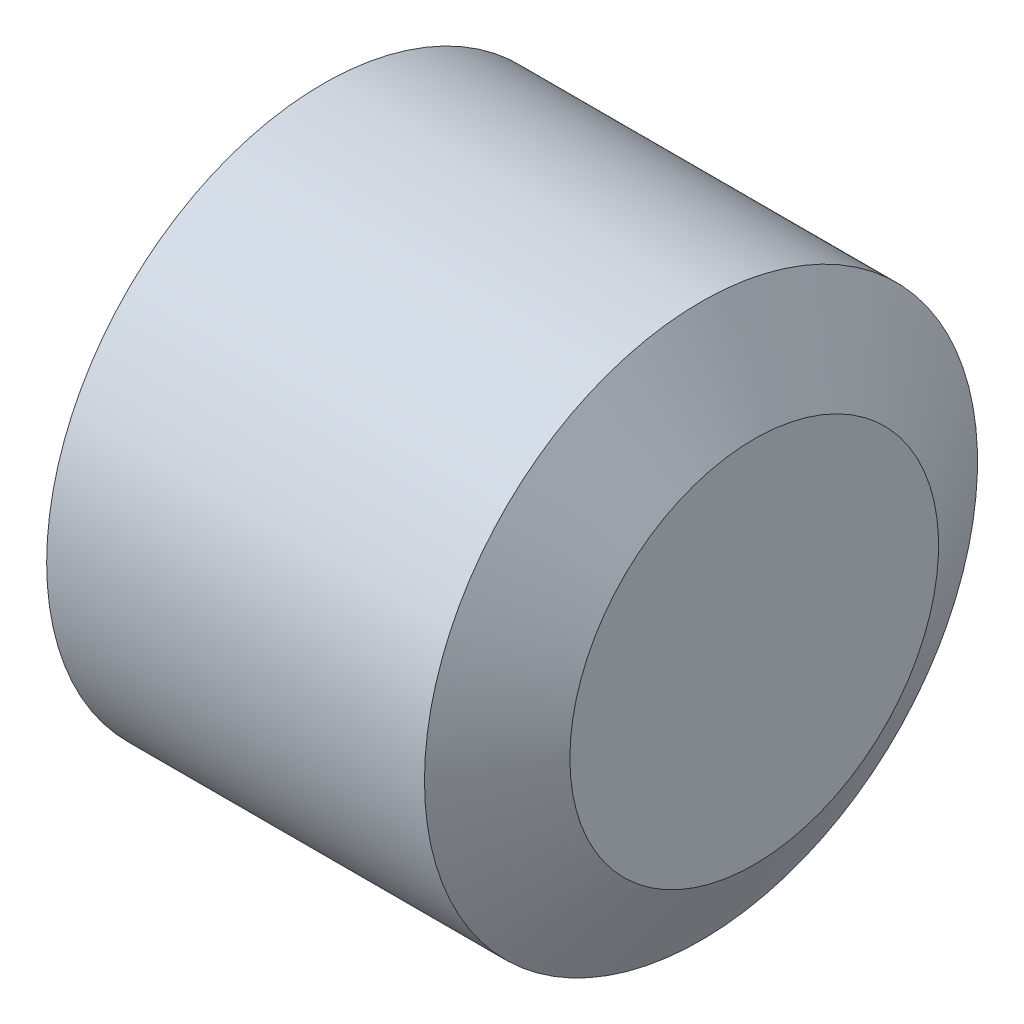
SolidWorks part; units mm, degrees
ref_plane "Plane1" through (0, 0, 0) normal (0, 0, 1) x (1, 0, 0)
ref_plane "Plane2" through (0, 0, 0) normal (0, 1, 0) x (1, 0, 0)
ref_plane "Plane3" through (0, 0, 0) normal (1, 0, 0) x (0, 0, -1)
sketch "BodySke" plane through (0, 0, 0) normal (0, 0, 1) x (1, 0, 0)
  line L0 (0, 0) -> (0, 1.2195)
  line L1 (0, 1.2195) -> (0.1619, 1.5)
  line L2 (0.1619, 1.5) -> (2.2113, 1.5)
  line L3 (2.2113, 1.5) -> (2.5, 1)
  line L4 (2.5, 0) -> (0, 0)
  line L5 (-12.7, 0) -> (88.9, 0) construction
  line L6 (2.5, 1) -> (2.5, 0)
  line L7 (2.5, 1) -> (2.5, 10.525) construction
  line L8 (0, -1.2195) -> (0.1619, -1.5) construction
  line L9 (0.5, 15.875) -> (0.5, -3.175) construction
  line L10 (2.2113, -1.5) -> (2.5, -1) construction
  dimension "Length" = 2.5
  dimension "Diameter" = 3
  dimension "Drive_ch_ang" = 60
  dimension "Minor_dia" = 2.439
  dimension "Cup_nose_ang" = 30
  dimension "Cup_dia" = 2
  dimension "Advance" = 0.5
revolve "BaseBody" add sketch "BodySke" angle 360 about L5
sketch "Sketch2" plane through (0, 0, 0) normal (-1, 0, 0) x (0, 0, 1)
  line L0 (0.433, 0.75) -> (-0.433, 0.75)
  line L1 (-0.433, 0.75) -> (-0.866, 0)
  line L2 (0.433, 0.75) -> (0.866, 0)
  line L3 (0.433, -0.75) -> (0.866, 0)
  line L4 (0.433, -0.75) -> (-0.433, -0.75)
  line L5 (-0.433, -0.75) -> (-0.866, 0)
  dimension "Hex_size" = 1.5
  dimension "D2" = 0.75
  dimension "D3" = 0.75
extrude "Hex" cut sketch "Sketch2" against normal blind 1.1
sketch "Sketch4" plane through (0, 4.7709, -0.5249) normal (-1, 0, 0) x (0, 0, 1)
  line L0 (0.5249, -4.7709) -> (1.3124, -4.7709)
  line L1 (0.5249, -4.7709) -> (6.6732, -1.2211) construction
  line L2 (0.5249, -4.7709) -> (0.9186, -4.0889)
  line L3 (1.153, -4.6137) -> (1.2782, -4.5415)
  line L4 (0.975, -4.3054) -> (1.1002, -4.2332)
  arc A0 (1.153, -4.6137) -> (0.975, -4.3054) centre (0.5249, -4.7709) ccw
  arc A1 (1.3124, -4.7709) -> (1.2782, -4.5415) centre (0.5249, -4.7709) ccw
  arc A2 (0.9186, -4.0889) -> (1.1002, -4.2332) centre (0.5249, -4.7709) cw
  circle A3 centre (0.5249, -4.7709) radius 0.6475 construction
  circle A4 centre (0.5249, -4.7709) radius 0.7875 construction
  dimension "D1" = 30
  dimension "Spline_n_dim" = 1.295
  dimension "Spline_m_dim" = 1.575
  dimension "Spline_a_dim" = 60
  dimension "D3" = 0.178
  dimension "Spline_p_dim" = 0.356
extrude "Spline6" [suppressed] cut sketch "Sketch4" against normal blind 1.1
pattern_circular "CirPattern1" [suppressed] count 6 every 60 about axis through (-12.7, 0, 0) along (1, 0, 0)
sketch "Sketch5" plane through (0, 0.6556, 6.6316) normal (-1, 0, 0) x (0, 0, 1)
  line L0 (-6.6316, -0.6556) -> (-5.8441, -0.6556)
  line L1 (-6.6316, -0.6556) -> (-1.6115, 4.3645) construction
  line L2 (-6.6316, -0.6556) -> (-6.6316, 0.1319)
  line L3 (-6.0479, -0.3236) -> (-5.9633, -0.239)
  line L4 (-6.2996, -0.0719) -> (-6.215, 0.0127)
  line L5 (-6.2996, -0.0719) -> (-6.0479, -0.3236)
  arc A1 (-5.8441, -0.6556) -> (-5.9633, -0.239) centre (-6.6316, -0.6556) ccw
  arc A2 (-6.6316, 0.1319) -> (-6.215, 0.0127) centre (-6.6316, -0.6556) cw
  circle A3 centre (-6.6316, -0.6556) radius 0.6475 construction
  circle A4 centre (-6.6316, -0.6556) radius 0.7875 construction
  dimension "D1" = 45
  dimension "Spline_n_dim" = 1.295
  dimension "Spline_m_dim" = 1.575
  dimension "Spline_a_dim" = 90
  dimension "D3" = 0.178
  dimension "Spline_p_dim" = 0.356
extrude "Spline4" [suppressed] cut sketch "Sketch5" against normal blind 1.1
pattern_circular "CirPattern2" [suppressed] count 4 every 90 about axis through (-12.7, 0, 0) along (1, 0, 0)
sketch "ThdSchSke" plane through (0, 0, 0) normal (0, 0, 1) x (1, 0, 0)
  line L0 (0.1619, -1.2195) -> (-0.0345, -1.5)
  line L1 (0.1619, -1.2195) -> (0.3584, -1.5)
  line L2 (0.3584, -1.5) -> (0.3584, -1.875)
  line L3 (-3.175, 0) -> (5.1513, 0) construction
  line L4 (0.1619, 1.5) -> (0.1619, -1.5) construction
  line L5 (0.3584, -1.875) -> (-0.0345, -1.875)
  line L6 (-0.0345, -1.875) -> (-0.0345, -1.5)
  dimension "Thread_minor" = 2.439
  dimension "Diameter" = 3
  dimension "SideAngle" = 55
  dimension "VeeAngle" = 70
  dimension "Overcut" = 3.75
revolve "ThreadSchematic" [suppressed] cut sketch "ThdSchSke" angle 360 about L3
pattern_linear "ThdSchPat" [suppressed]
equation "\"D2@Sketch2\" = \"Hex_size@Sketch2\" / 2"
equation "\"D3@Sketch2\" = \"Hex_size@Sketch2\" / 2"
equation "\"Thread_minor@ThreadCosmetic\" = \"Minor_dia@BodySke\""
equation "\"D1@Sketch4\" = \"Spline_a_dim@Sketch4\" / 2"
equation "\"D3@Sketch4\" = \"Spline_p_dim@Sketch4\" / 2"
equation "\"D2@CirPattern1\" = \"Spline_a_dim@Sketch4\""
equation "\"Num_teeth@CirPattern1\" = 360 / \"D2@CirPattern1\""
equation "\"Spline_a_dim@Sketch5\" = 90"
equation "\"Spline_p_dim@Sketch5\" = \"Spline_p_dim@Sketch4\""
equation "\"Spline_m_dim@Sketch5\" = \"Spline_m_dim@Sketch4\""
equation "\"Spline_n_dim@Sketch5\" = \"Spline_n_dim@Sketch4\""
equation "\"D1@Sketch5\" = \"Spline_a_dim@Sketch5\" / 2"
equation "\"D3@Sketch5\" = \"Spline_p_dim@Sketch5\" / 2"
equation "\"Key_eng@Spline4\" = \"Key_eng@Spline6\""
equation "\"Thread_minor@ThdSchSke\" = \"Thread_minor@ThreadCosmetic\""
equation "\"Diameter@ThdSchSke\" = \"Diameter@BodySke\""
equation "\"Overcut@ThdSchSke\" = \"Diameter@BodySke\" * 1.25"
equation "\"Num_threads@ThdSchPat\" = int( (\"Length@BodySke\" - ( ( ( \"Diameter@BodySke\" - \"Minor_dia@BodySke\" ) * 0.5 ) / tan( \"Drive_ch_ang@BodySke\" * 0.017453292 ) ) - ( ( ( \"Diameter@BodySke\" - \"Cup_dia@BodySk"
equation "\"Advance@ThdSchPat\" = (\"Length@BodySke\" - ( ( ( \"Diameter@BodySke\" - \"Minor_dia@BodySke\" ) * 0.5 ) / tan( \"Drive_ch_ang@BodySke\" * 0.017453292 ) ) - ( ( ( \"Diameter@BodySke\" - \"Cup_dia@BodySke\" ) * 0."
equation "' \"Num_threads@ThdSchPat\" = \"Num_threads@ThdSchPat\" - sgn( \"Num_threads@ThdSchPat\" - 1) '---chamfered tips only---"
